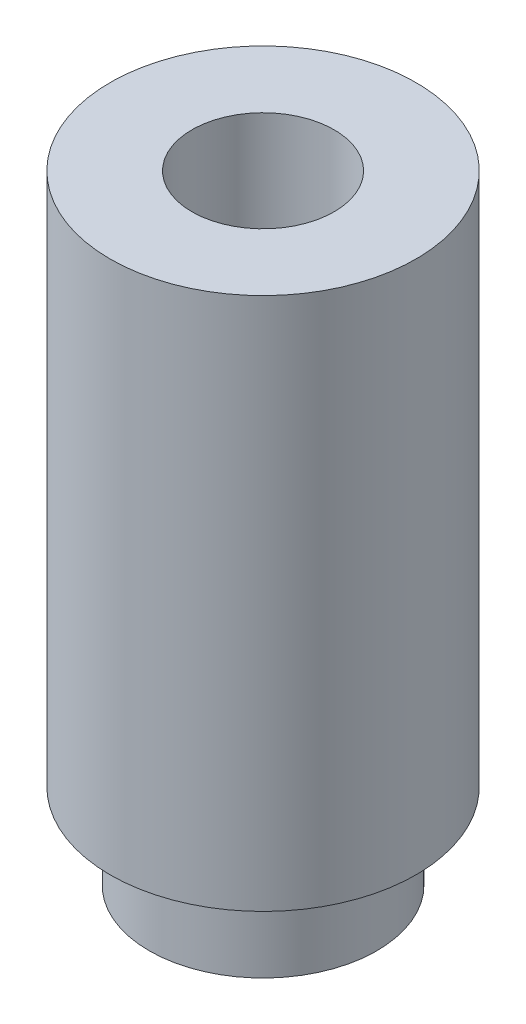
SolidWorks part; units mm, degrees
ref_plane "Front Plane" through (0, 0, 0) normal (0, 0, 1) x (1, 0, 0)
ref_plane "Top Plane" through (0, 0, 0) normal (0, 1, 0) x (1, 0, 0)
ref_plane "Right Plane" through (0, 0, 0) normal (1, 0, 0) x (0, 0, -1)
sketch "Sketch2" plane through (0, 0, 0) normal (0, 0, 1) x (1, 0, 0)
  line L0 (1, 7.5) -> (2.15, 7.5)
  line L1 (2.15, 7.5) -> (2.15, 0)
  line L2 (2.365, 0) -> (-2.365, 0) construction
  line L3 (2.15, 0) -> (1.6, 0)
  line L4 (1.6, 0) -> (1.6, -1.2)
  line L5 (1.6, -1.2) -> (1, -1.2)
  line L6 (1, -1.2) -> (1, 7.5)
  line L7 (0, 7.5) -> (0, 0) construction
  line L8 (0, -2.365) -> (0, 2.365) construction
  dimension "D1" = 2
  dimension "D2" = 3.2
  dimension "D3" = 4.3
  dimension "D4" = 7.5
  dimension "D5" = 1.2
revolve "Revolve1" add sketch "Sketch2" angle 360 about L7
